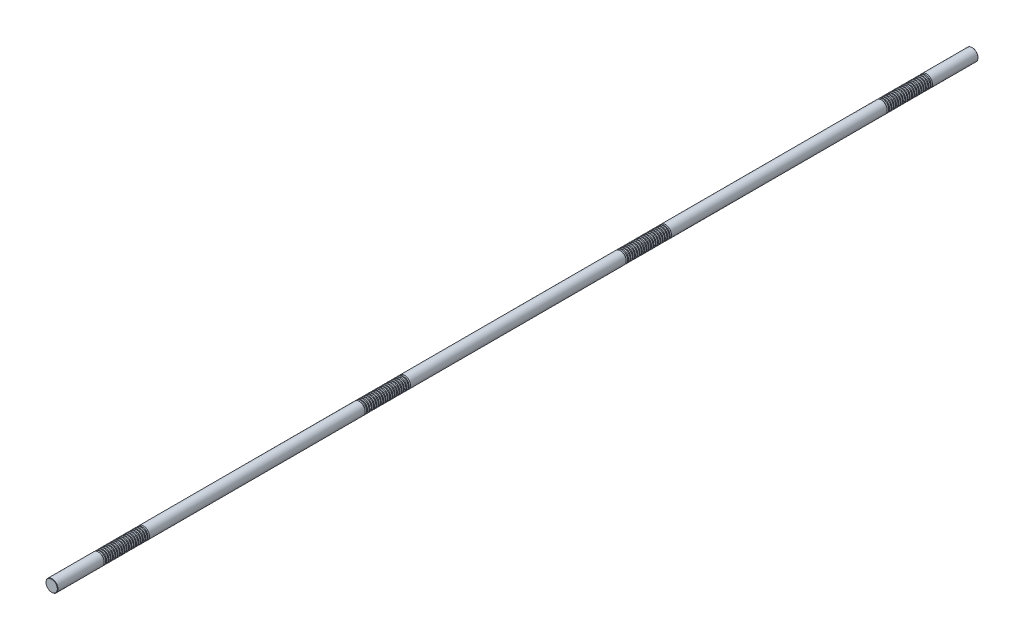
SolidWorks part; units mm, degrees
ref_plane "Front Plane" through (0, 0, 0) normal (0, 0, 1) x (1, 0, 0)
ref_plane "Top Plane" through (0, 0, 0) normal (0, 1, 0) x (1, 0, 0)
ref_plane "Right Plane" through (0, 0, 0) normal (1, 0, 0) x (0, 0, -1)
sketch "Sketch1" plane through (0, 0, 0) normal (0, 0, 1) x (1, 0, 0)
  circle A0 centre (0, 0) radius 13
  dimension "D1" = 26
extrude "Boss-Extrude1" add sketch "Sketch1" along normal mid plane 2000
chamfer "Chamfer1" distance 0.65 angle 45 2 edges at (13, 0, -1000) (13, 0, 1000)
sketch "Sketch2" plane through (0, 0, 0) normal (1, 0, 0) x (0, 0, -1)
  line L0 (900.3684, 13) -> (897.1316, 13)
  line L1 (999.35, 13) -> (-999.35, 13) construction
  line L2 (897.1316, 13) -> (897.8684, 10.25)
  line L3 (897.8684, 10.25) -> (899.6316, 10.25)
  line L4 (899.6316, 10.25) -> (900.3684, 13)
  line L5 (1000, -12.35) -> (1000, 12.35) construction
  point P4 (898.75, 13)
  point P7 (898.75, 10.25)
  point P8 (900, 11.625)
  point P9 (897.5, 11.625)
  dimension "D1" = 2.5
  dimension "D2" = 100
  dimension "D3" = 2.75
  dimension "D4" = 30
revolve "Cut-Revolve1" cut sketch "Sketch2" angle 360 about axis through (0, 0, 1000) along (0, 0, -1)
pattern_linear "LPattern1" count 20 spacing 5 along (0, 0, 1) of "Cut-Revolve1"
pattern_linear "LPattern2" count 4 spacing 567 along (0, 0, 1) of "Cut-Revolve1", "LPattern1"
